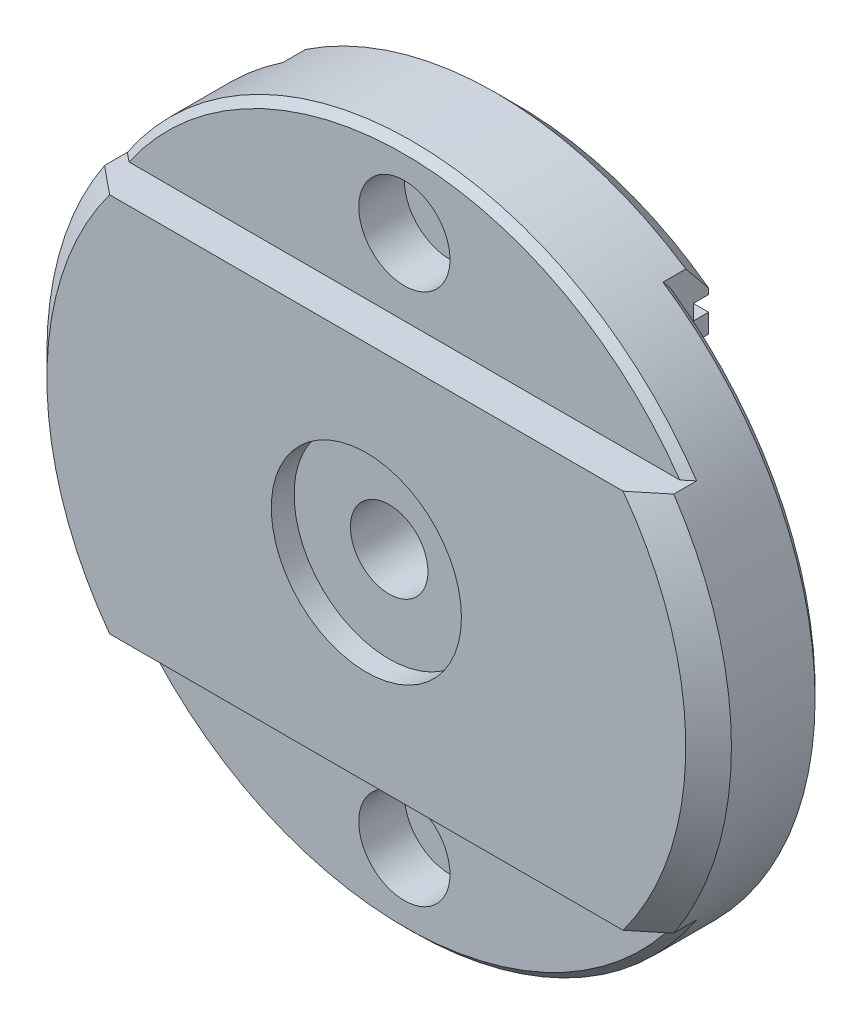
SolidWorks part; units mm, degrees
ref_plane "Front" through (0, 0, 0) normal (0, 0, 1) x (1, 0, 0)
ref_plane "Top" through (0, 0, 0) normal (0, 1, 0) x (1, 0, 0)
ref_plane "Right" through (0, 0, 0) normal (1, 0, 0) x (0, 0, -1)
sketch "Sketch1" plane through (0, 0, 0) normal (0, 0, 1) x (1, 0, 0)
  circle A0 centre (0, 0) radius 45
  dimension "D1" = 90
extrude "Base" add sketch "Sketch1" against normal blind 20
sketch "Sketch2" plane through (0, 0, 0) normal (0, 0, 1) x (1, 0, 0)
  line L1 (45, -25) -> (-45, -25)
  line L2 (45, -25) -> (45, 25)
  line L3 (45, 25) -> (-45, 25)
  line L4 (-45, -25) -> (-45, 25)
  line L5 (45, -25) -> (-45, 25) construction
  line L6 (45, 25) -> (-45, -25) construction
  circle A0 centre (0, 0) radius 45 construction
  point P0 (0, 0)
extrude "Cut1" cut sketch "Sketch2" against normal blind 5 flip side to cut
sketch "Sketch3" plane through (0, 0, -20) normal (0, 0, -1) x (-1, 0, 0)
  line L1 (25, -45) -> (-25, -45)
  line L2 (25, -45) -> (25, 45)
  line L3 (25, 45) -> (-25, 45)
  line L4 (-25, -45) -> (-25, 45)
  line L5 (25, -45) -> (-25, 45) construction
  line L6 (25, 45) -> (-25, -45) construction
  circle A0 centre (0, 0) radius 45 construction
  point P0 (0, 0)
extrude "Cut2" cut sketch "Sketch3" against normal blind 5 flip side to cut
sketch "Sketch4" plane through (0, 0, 0) normal (0, 0, 1) x (1, 0, 0)
  circle A0 centre (0, 0) radius 12.5
  dimension "D1" = 25
extrude "Recess" cut sketch "Sketch4" against normal blind 3
hole_wizard "M12 Tapped Hole1" positions "Sketch6" profile "Sketch5" tap size "M12" standard "ISO"
sketch "Sketch6" plane through (0, 0, -3) normal (0, 0, 1) x (1, 0, 0)
  point P0 (0, 0)
sketch "Sketch5" plane through (0, 0, -3) normal (1, 0, 0) x (0, -1, 0)
  line L0 (0, 0) -> (0, 17)
  line L1 (0, 17) -> (5.1, 17)
  line L2 (5.1, 17) -> (5.1, 0)
  line L5 (5.1, 0) -> (0, 0)
  line L11 (0, -6.35) -> (0, 107.95) construction
  dimension "Thru Tap Drill Dia." = 10.2
  dimension "Thru Tap Drill Depth" = 17
sketch "Sketch7" plane through (0, 0, -20) normal (0, 0, -1) x (-1, 0, 0)
  line L0 (-25, 37.4166) -> (-25, -37.4166) construction
  line L1 (-25, 33) -> (25, 33)
  line L2 (-25, 33) -> (-25, 31)
  line L3 (-25, 31) -> (25, 31)
  line L4 (25, 33) -> (25, 31)
  line L5 (25, -37.4166) -> (25, 37.4166) construction
  dimension "D1" = 2
  dimension "D2" = 33
extrude "Slot-cut" cut sketch "Sketch7" against normal blind 2
pattern_linear "Slot-Pattern" count 6 spacing 4.5 along (0, -1, 0) of "Slot-cut"
mirror "Mirror1" about plane through (0, 0, 0) normal (0, 1, 0) of "Slot-Pattern", "Slot-cut"
sketch "Sketch10" plane through (0, 0, -5) normal (0, 0, 1) x (1, 0, 0)
  line L0 (0, 0) -> (12.5, 0) construction
  circle A0 centre (0, -35) radius 6
  circle A1 centre (0, 0) radius 35 construction
  circle A2 centre (0, 35) radius 6
  circle A3 centre (0, 0) radius 12.5 construction
  circle A4 centre (0, 0) radius 12.5 construction
  dimension "D1" = 70
  dimension "D2" = 12
extrude "Holes1" cut sketch "Sketch10" against normal blind 6
sketch "Sketch8" plane through (0, 0, -15) normal (0, 0, -1) x (-1, 0, 0)
  line L0 (0, 0) -> (0, 4.343) construction
  circle A0 centre (-35, 0) radius 6
  circle A1 centre (0, 0) radius 35 construction
  circle A2 centre (35, 0) radius 6
  dimension "D1" = 70
  dimension "D2" = 12
extrude "Holes2" cut sketch "Sketch8" against normal blind 6
chamfer "Chamfer2" distance 1 angle 45 4 edges at (45, 0, -15) (-45, 0, -15) (0, -45, -5) (0, 45, -5)
chamfer "Chamfer1" distance 3 angle 45 4 edges at (45, 0, 0) (-45, 0, 0) (0, 45, -20) (0, -45, -20)
